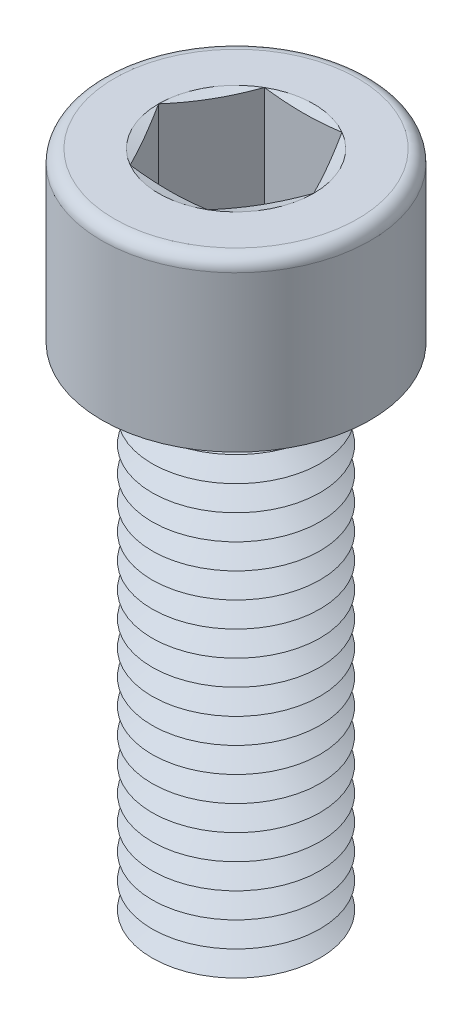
SolidWorks part; units mm, degrees
ref_plane "Front Plane" through (0, 0, 0) normal (0, 0, 1) x (1, 0, 0)
ref_plane "Top Plane" through (0, 0, 0) normal (0, 1, 0) x (1, 0, 0)
ref_plane "Right Plane" through (0, 0, 0) normal (1, 0, 0) x (0, 0, -1)
sketch "Sketch1" plane through (0, 0, 0) normal (0, 1, 0) x (1, 0, 0)
  circle A0 centre (0, 0) radius 5
  dimension "D1" = 10
extrude "Extrude1" add sketch "Sketch1" along normal blind 30
sketch "Sketch2" plane through (0, 30, 0) normal (0, 1, 0) x (1, 0, 0)
  circle A0 centre (0, 0) radius 8
  dimension "D1" = 16
extrude "Extrude2" add sketch "Sketch2" along normal blind 10
sketch "Sketch3" plane through (0, 40, 0) normal (0, 1, 0) x (1, 0, 0)
  line L1 (2.3094, 4) -> (-2.3094, 4)
  line L2 (-2.3094, 4) -> (-4.6188, 0)
  line L3 (-4.6188, 0) -> (-2.3094, -4)
  line L4 (-2.3094, -4) -> (2.3094, -4)
  line L5 (2.3094, -4) -> (4.6188, 0)
  line L6 (4.6188, 0) -> (2.3094, 4)
  circle A0 centre (0, 0) radius 4 construction
  dimension "D1" = 8
extrude "Extrude3" cut sketch "Sketch3" against normal blind 8
fillet "Fillet1" radius 0.75 1 edges at (0, 40, 8)
sketch "Sketch4" plane through (0, 0, 0) normal (1, 0, 0) x (0, 0, -1)
  line L0 (-4, 32) -> (0, 32)
  line L1 (0, 32) -> (0, 29.6906)
  line L2 (0, 29.6906) -> (-4, 32)
  dimension "D1" = 30
revolve "Cut-Revolve1" cut sketch "Sketch4" angle 360 about L1
sketch "Sketch5" plane through (0, 0, 0) normal (0, 0, 1) x (1, 0, 0)
  line L0 (-5, 0.75) -> (-5, -0.75)
  line L1 (-5, 30) -> (-5, 0) construction
  line L2 (-5, -0.75) -> (-3.701, 0)
  line L3 (-5, 0) -> (5, 0) construction
  line L4 (-3.701, 0) -> (-5, 0.75)
  dimension "D1" = 1.5
revolve "Cut-Revolve2" cut sketch "Sketch5" angle 360 about axis through (0, 30, 0) along (0, -1, 0)
pattern_linear "LPattern1" count 20 spacing 1.5 along (0, 1, 0) of "Cut-Revolve2"
sketch "Sketch6" plane through (0, 40, 0) normal (0, 1, 0) x (1, 0, 0)
  circle A0 centre (0, 0) radius 4.6188
extrude "Extrude4" cut sketch "Sketch6" against normal through all draft 75
